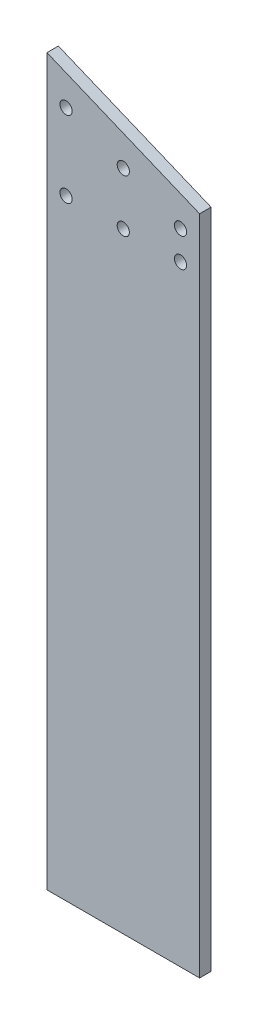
SolidWorks part; units mm, degrees
ref_plane "Plan de face" through (0, 0, 0) normal (0, 0, 1) x (1, 0, 0)
ref_plane "Plan de dessus" through (0, 0, 0) normal (0, 1, 0) x (1, 0, 0)
ref_plane "Plan de droite" through (0, 0, 0) normal (1, 0, 0) x (0, 0, -1)
sketch "Esquisse1" plane through (0, 0, 0) normal (0, 0, 1) x (1, 0, 0)
  line L1 (100, -475) -> (-100, -475)
  line L2 (100, -475) -> (100, 475)
  line L3 (100, 475) -> (-100, 475)
  line L4 (-100, -475) -> (-100, 475)
  line L5 (100, -475) -> (-100, 475) construction
  line L6 (100, 475) -> (-100, -475) construction
  point P0 (0, 0)
  dimension "D1" = 475
  dimension "D2" = 100
extrude "Boss.-Extru.1" add sketch "Esquisse1" along normal blind 15
sketch "Esquisse2" plane through (0, 0, 15) normal (0, 0, 1) x (1, 0, 0)
  line L0 (-100, 475) -> (100, 392.1573)
  line L1 (100, -475) -> (100, 475) construction
  line L2 (100, 392.1573) -> (100, 475)
  line L3 (100, 475) -> (-100, 475)
  dimension "D1" = 22.5
extrude "Enlèv. mat.-Extru.1" cut sketch "Esquisse2" against normal blind 15
sketch "Esquisse3" plane through (0, 0, 15) normal (0, 0, 1) x (1, 0, 0)
  line L0 (-100, 475) -> (-100, -475) construction
  line L1 (-147.1215, 325) -> (129.6065, 325) construction
  line L2 (-75, 131.0981) -> (-75, 340.3493) construction
  line L3 (-75, 425) -> (176.4523, 320.8451) construction
  line L4 (-100, 475) -> (100, 392.1573) construction
  line L5 (0, 141.5196) -> (0, 309.0733) construction
  line L6 (75, 141.5196) -> (75, 254.4772) construction
  circle A0 centre (-75, 325) radius 8
  circle A1 centre (0, 325) radius 8
  circle A2 centre (75, 325) radius 8
  circle A3 centre (-75, 425) radius 8
  circle A4 centre (0, 393.934) radius 8
  circle A5 centre (75, 362.8679) radius 8
  dimension "D5" = 16
  dimension "D6" = 16
  dimension "D7" = 16
  dimension "D8" = 16
  dimension "D11" = 16
  dimension "D13" = 16
  dimension "D1" = 150
  dimension "D2" = 25
  dimension "D3" = 75
  dimension "D4" = 75
  dimension "D9" = 25
  dimension "D10" = 50
  dimension "D12" = 68.934
  dimension "D14" = 37.8679
extrude "Enlèv. mat.-Extru.2" cut sketch "Esquisse3" against normal through all
